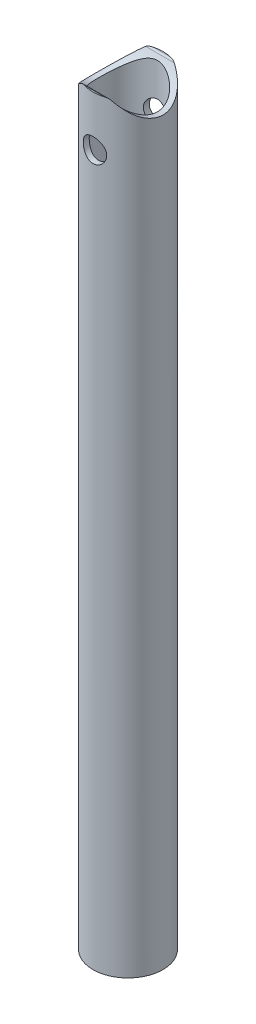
SolidWorks part; units mm, degrees
ref_plane "Ebene vorne" through (0, 0, 0) normal (0, 0, 1) x (1, 0, 0)
ref_plane "Ebene oben" through (0, 0, 0) normal (0, 1, 0) x (1, 0, 0)
ref_plane "Ebene rechts" through (0, 0, 0) normal (1, 0, 0) x (0, 0, -1)
ref_plane "Ebene1" through (0, 134.5, 0) normal (0, 1, 0) x (-1, 0, 0)
sketch "Skizze1" plane through (0, 134.5, 0) normal (0, 1, 0) x (1, 0, 0)
  circle A0 centre (0, 0) radius 13.3
  circle A1 centre (0, 0) radius 15.8
extrude "Aufsatz-Linear austragen1" add sketch "Skizze1" along normal blind 40 and the other way blind 310
sketch "Skizze2" plane through (0, 0, 0) normal (1, 0, 0) x (0, 0, -1)
  line L0 (-15.3039, 167.5) -> (-25.0069, 167.5)
  line L1 (-35.0069, 177.5) -> (-35.0069, 197.5)
  line L2 (-25.0069, 207.5) -> (24.9931, 207.5)
  line L3 (34.9931, 197.5) -> (34.9931, 177.5)
  line L4 (-35.0069, 175) -> (34.9931, 175) construction
  line L5 (15.2902, 167.5) -> (24.9931, 167.5)
  line L6 (-0.0069, 175) -> (-0.0069, 134.5) construction
  circle A0 centre (-0.0069, 175) radius 16.5 construction
  arc A1 (-14.4298, 166.9857) -> (14.4161, 166.9857) centre (-0.0069, 175) ccw
  arc A2 (-25.0069, 167.5) -> (-35.0069, 177.5) centre (-25.0069, 177.5) cw
  arc A3 (24.9931, 167.5) -> (34.9931, 177.5) centre (24.9931, 177.5) ccw
  arc A4 (24.9931, 207.5) -> (34.9931, 197.5) centre (24.9931, 197.5) cw
  arc A5 (-35.0069, 197.5) -> (-25.0069, 207.5) centre (-25.0069, 197.5) cw
  arc A6 (-15.3039, 167.5) -> (-14.4298, 166.9857) centre (-15.3039, 166.5) cw
  arc A7 (14.4161, 166.9857) -> (15.2902, 167.5) centre (15.2902, 166.5) cw
  dimension "D1" = 10
  dimension "D2" = 10
  dimension "D3" = 1
  dimension "D4" = 1
extrude "Schnitt-Linear austragen2" cut sketch "Skizze2" against normal through all and the other way through all
sketch "Skizze3" plane through (0, 0, 0) normal (0, 0, 1) x (1, 0, 0)
  circle A0 centre (0, 144.8) radius 5.3
extrude "Schnitt-Linear austragen3" cut sketch "Skizze3" against normal through all and the other way through all
